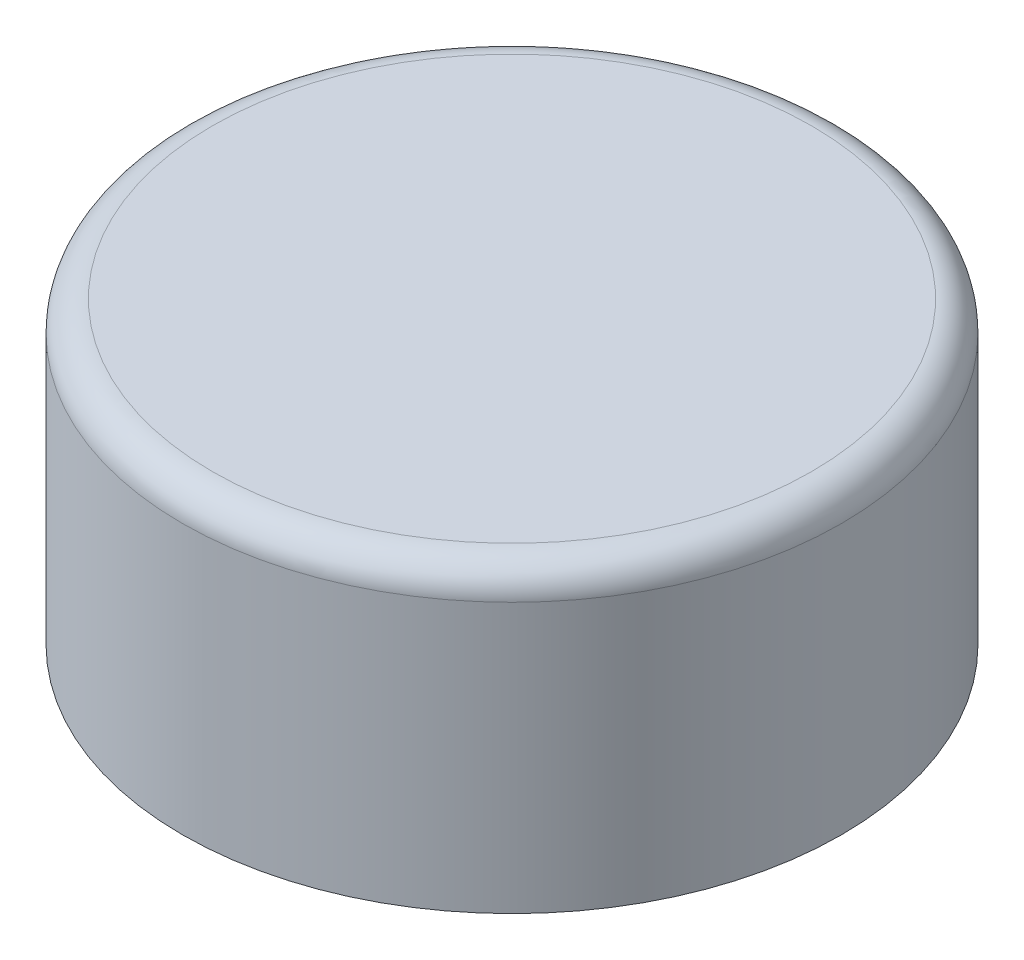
SolidWorks part; units mm, degrees
ref_plane "Face" through (0, 0, 0) normal (0, 0, 1) x (1, 0, 0)
ref_plane "Dessus" through (0, 0, 0) normal (0, 1, 0) x (1, 0, 0)
ref_plane "Droite" through (0, 0, 0) normal (1, 0, 0) x (0, 0, -1)
sketch "Esquisse1" plane through (0, 0, 0) normal (0, 0, 1) x (1, 0, 0)
  line L0 (0, 0) -> (0, 45.1497) construction
  line L1 (0, 0) -> (-13.2, 0)
  line L2 (-13.2, 0) -> (-13.2, 10.8)
  line L3 (-12, 12) -> (0, 12)
  line L4 (0, 0) -> (0, 12)
  arc A0 (-13.2, 10.8) -> (-12, 12) centre (-12, 10.8) cw
  point P8 (-13.2, 12)
  dimension "D3" = 1.2
  dimension "D1" = 12
  dimension "D2" = 13.2
revolve "Révolution1" add sketch "Esquisse1" angle 360 about L0
